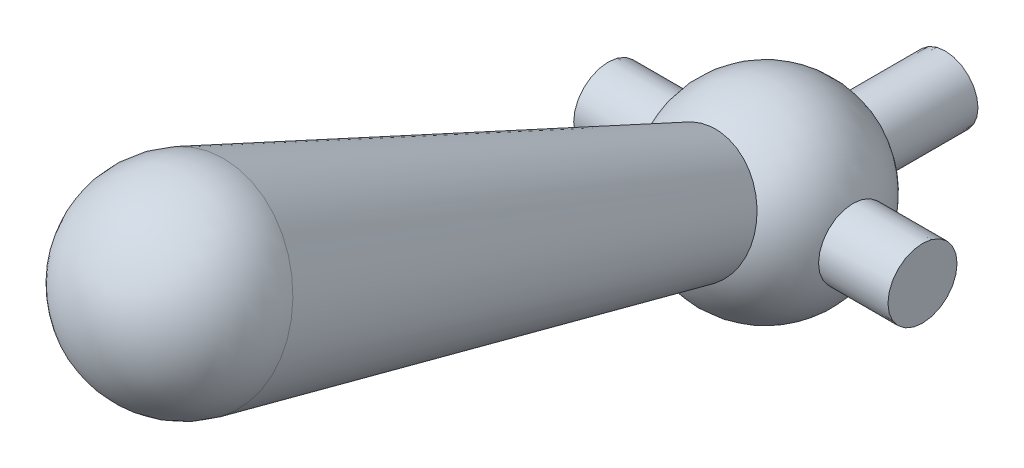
SolidWorks part; units mm, degrees
ref_plane "Front Plane" through (0, 0, 0) normal (0, 0, 1) x (1, 0, 0)
ref_plane "Top Plane" through (0, 0, 0) normal (0, 1, 0) x (1, 0, 0)
ref_plane "Right Plane" through (0, 0, 0) normal (1, 0, 0) x (0, 0, -1)
sketch "Sketch1" plane through (0, 0, 0) normal (1, 0, 0) x (0, 0, -1)
  line L0 (2.8191, -1.0261) -> (-21.425, 7.7981)
  line L1 (-17.2436, 9.5665) -> (-1.5865, 2.5462)
  line L2 (0, 0) -> (-29.5338, 0) construction
  arc A0 (2.8191, -1.0261) -> (-1.5865, 2.5462) centre (0, 0) ccw
  arc A1 (-17.2436, 9.5665) -> (-21.425, 7.7981) centre (-18.5119, 6.7378) ccw
  dimension "D2" = 3
  dimension "D3" = 3.1
  dimension "D1" = 1.85
  dimension "D4" = 19.7
  dimension "D5" = 20
revolve "Revolve1" add sketch "Sketch1" angle 360 about L0
sketch "Sketch2" plane through (0, 0, 0) normal (1, 0, 0) x (0, 0, -1)
  line L1 (0, 0) -> (5.7187, 0)
  line L2 (0, 0) -> (0, 1.0474)
  line L3 (0, 1.0474) -> (5.7187, 1.0474)
  line L4 (5.7187, 0) -> (5.7187, 1.0474)
revolve "Revolve2" add sketch "Sketch2" angle 360 about L1
sketch "Sketch3" plane through (0, 0, 0) normal (1, 0, 0) x (0, 0, -1)
  circle A0 centre (0, 0) radius 1.1
  dimension "D1" = 2.2
extrude "Extrude1" add sketch "Sketch3" along normal mid plane 10
